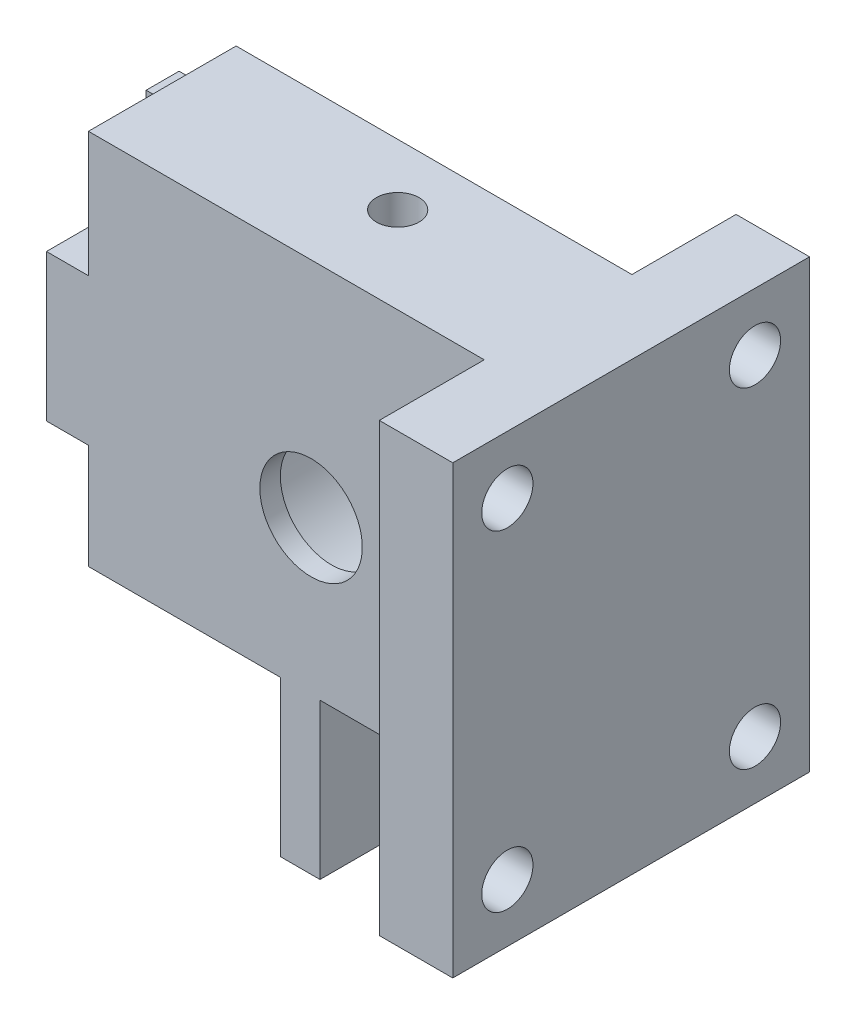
SolidWorks part; units mm, degrees
ref_plane "Front" through (0, 0, 0) normal (0, 0, 1) x (1, 0, 0)
ref_plane "Top" through (0, 0, 0) normal (0, 1, 0) x (1, 0, 0)
ref_plane "Right" through (0, 0, 0) normal (1, 0, 0) x (0, 0, -1)
sketch "Sketch1" plane through (0, 0, 0) normal (0, 0, 1) x (1, 0, 0)
  line L0 (53.34, 11.811) -> (53.34, -11.811) construction
  line L1 (3.9672, 13.5001) -> (40.34, 13.5001)
  line L2 (3.9672, 13.5001) -> (3.9672, -13.5001)
  line L3 (3.9672, -13.5001) -> (40.34, -13.5001)
  line L4 (40.34, 13.5001) -> (40.34, -13.5001)
  circle A0 centre (0, 0) radius 7.9375 construction
  circle A1 centre (25.4, 0) radius 8.5 construction
  point P4 (3.9672, 0)
  dimension "D1" = 15.875
  dimension "D2" = 17
  dimension "D3" = 36.3728
  dimension "D9" = 13
  dimension "D4" = 25.4
  dimension "D6" = 53.34
  dimension "D7" = 27.0002
extrude "Extrude1" add sketch "Sketch1" along normal blind 21.59
sketch "Sketch12" plane through (0, 0, 0) normal (0, 0, -1) x (-1, 0, 0)
  circle A0 centre (0, 0) radius 7.9375
  dimension "D1" = 15.875
sketch "Sketch16" plane through (0, 0, 0) normal (0, 0, -1) x (-1, 0, 0)
  line L0 (-40.34, 13.5001) -> (-3.9672, 13.5001) construction
  line L1 (-40.34, -13.5001) -> (-40.34, 13.5001) construction
  line L2 (-11.9428, 13.5001) -> (-11.9428, -13.5001)
  line L4 (-35.895, -13.5001) -> (-35.895, 13.5001) construction
  line L5 (-11.9428, 13.5001) -> (3.2177, 13.5001)
  line L6 (-11.9428, -13.5001) -> (3.2177, -13.5001)
  line L7 (3.2177, -13.5001) -> (3.2177, 13.5001)
  dimension "D1" = 4.445
  dimension "D2" = 28.3972
extrude "Cut-Extrude5" cut sketch "Sketch16" against normal offset from surface (1.778 mm away) 19.812
sketch "Sketch33" plane through (0, 0, 0) normal (0, 1, 0) x (1, 0, 0)
  line L0 (40.34, -21.59) -> (40.34, 0) construction
  line L1 (-3.4131, -28.892) -> (35.895, -28.892)
  line L2 (-3.4131, -28.892) -> (-3.4131, -15.24)
  line L3 (-3.4131, -15.24) -> (35.895, -15.24)
  line L4 (35.895, -28.892) -> (35.895, -15.24)
  line L5 (40.34, 0) -> (11.9428, 0) construction
  dimension "D1" = 4.445
  dimension "D2" = 15.24
extrude "Cut-Extrude6" cut sketch "Sketch33" against normal through all and the other way through all
ref_plane "Plane1" through (0, 0, 4.445) normal (0, 0, 1) x (1, 0, 0)
sketch "Sketch20" plane through (0, 0, 0) normal (0, 0, -1) x (-1, 0, 0)
  line L0 (-24.765, 1.4431) -> (-24.765, -20.0804) construction
  line L1 (-32.385, -9.3091) -> (-3.9672, -9.3091)
  line L2 (-32.385, -9.3091) -> (-32.385, -15.3438)
  line L3 (-32.385, -15.3438) -> (-3.9672, -15.3438)
  line L4 (-3.9672, -9.3091) -> (-3.9672, -15.3438)
  line L5 (-11.9428, -13.5001) -> (-40.34, -13.5001) construction
  line L6 (-3.9672, 13.5001) -> (-3.9672, -13.5001) construction
  dimension "D1" = 24.765
  dimension "D2" = 4.191
  dimension "D3" = 7.62
extrude "Cut-Extrude1" cut sketch "Sketch20" against normal through all
sketch "Sketch21" plane through (0, -9.3091, 0) normal (0, -1, 0) x (1, 0, 0)
  line L1 (23.5744, 15.24) -> (25.9556, 15.24)
  line L2 (23.5744, 15.24) -> (23.5744, 6.35)
  line L3 (23.5744, 6.35) -> (25.9556, 6.35)
  line L4 (25.9556, 15.24) -> (25.9556, 6.35)
  line L6 (24.765, 15.24) -> (24.765, 3.3753) construction
  line L7 (3.9672, 15.24) -> (32.385, 15.24) construction
  dimension "D1" = 2.3813
  dimension "D2" = 24.765
  dimension "D3" = 8.89
extrude "Sensor Tab" add sketch "Sketch21" along normal blind 9.398
ref_plane "SENSOR" through (24.765, 0, 0) normal (1, 0, 0) x (0, 0, -1)
sketch "Sketch34" plane through (0, 0, 0) normal (0, 0, -1) x (-1, 0, 0)
  line L0 (-40.34, 13.5001) -> (-11.9428, 13.5001) construction
  line L1 (-40.34, -13.5001) -> (-40.34, 13.5001) construction
  circle A0 centre (-25.4175, -0.0127) radius 6
  dimension "D3" = 12
  dimension "D1" = 13.5128
  dimension "D2" = 14.9225
extrude "Ball Nut Bore" cut sketch "Sketch34" against normal blind 14
hole_wizard "Ø6.2 (6.2) Diameter Hole1" positions "Sketch43" profile "Sketch42" hole size "Ø6.2" standard "Ansi Metric"
sketch "Sketch43" plane through (0, 0, 0) normal (0, 0, -1) x (-1, 0, 0)
  point P0 (-25.4175, -0.0127)
sketch "Sketch42" plane through (25.4175, -0.0127, 0) normal (1, 0, 0) x (0, 1, 0)
  line L0 (0, 0) -> (0, 21.59)
  line L1 (0, 21.59) -> (3.1, 21.59)
  line L2 (3.1, 21.59) -> (3.1, 0)
  line L5 (3.1, 0) -> (0, 0)
  line L11 (0, -6.35) -> (0, 107.95) construction
  dimension "Thru Hole Dia." = 6.2
  dimension "Thru Hole Depth" = 21.59
sketch "Sketch35" plane through (0, 0, 1.778) normal (0, 0, -1) x (-1, 0, 0)
  line L0 (-11.9428, 13.5001) -> (-11.9428, -9.3091) construction
  line L1 (-11.9428, 13.5001) -> (-1.4852, 13.5001)
  line L2 (-11.9428, 13.5001) -> (-11.9428, 5.9309)
  line L3 (-11.9428, 5.9309) -> (-1.4852, 5.9309)
  line L4 (-1.4852, 13.5001) -> (-1.4852, 5.9309)
  line L5 (-11.9428, -2.954) -> (-1.4852, -2.954)
  line L6 (-11.9428, -2.954) -> (-11.9428, -14.1692)
  line L7 (-11.9428, -14.1692) -> (-1.4852, -14.1692)
  line L8 (-1.4852, -2.954) -> (-1.4852, -14.1692)
  dimension "D1" = 7.5692
  dimension "D2" = 8.8849
extrude "Cut-Extrude8" cut sketch "Sketch35" against normal through all
sketch "Sketch36" plane through (0, 0, 0) normal (0, 1, 0) x (1, 0, 0)
  line L0 (40.34, 0) -> (11.9428, 0) construction
  line L1 (2.2222, -26.4633) -> (17.5862, -26.4633) construction
  line L2 (2.2222, -26.4633) -> (2.2222, -19.812) construction
  line L3 (2.2222, -19.812) -> (17.5862, -19.812) construction
  line L4 (17.5862, -26.4633) -> (17.5862, -19.812) construction
  line L5 (2.2222, -16.002) -> (9.4028, -16.002)
  line L6 (2.2222, -16.002) -> (2.2222, -3.7709)
  line L7 (2.2222, -3.7709) -> (9.4028, -3.7709)
  line L8 (9.4028, -16.002) -> (9.4028, -3.7709)
  line L9 (40.34, -21.59) -> (40.34, 0) construction
  dimension "D1" = 16.002
  dimension "D2" = 19.812
  dimension "D3" = 30.9372
extrude "Cut-Extrude9" cut sketch "Sketch36" against normal through all and the other way through all
hole_wizard "Ø3.1 (3.1) Diameter Hole1" positions "Sketch38" profile "Sketch37" hole size "Ø3.1" standard "Ansi Metric"
sketch "Sketch38" plane through (40.34, 0, 0) normal (1, 0, 0) x (0, 0, -1)
  line L0 (-21.59, 13.5001) -> (0, 13.5001) construction
  line L1 (-21.59, -13.5001) -> (-21.59, 13.5001) construction
  point P0 (-18.288, 9.9949)
  point P3 (-18.288, -9.9949)
  point P7 (-3.302, 9.9949)
  point P9 (-3.302, -9.9949)
  dimension "D1" = 3.5052
  dimension "D2" = 19.9898
  dimension "D3" = 3.302
  dimension "D4" = 14.986
sketch "Sketch37" plane through (40.34, 9.9949, 18.288) normal (0, 1, 0) x (0, 0, -1)
  line L0 (0, 0) -> (0, 36.3728)
  line L1 (0, 36.3728) -> (1.55, 36.3728)
  line L2 (1.55, 36.3728) -> (1.55, 0)
  line L5 (1.55, 0) -> (0, 0)
  line L11 (0, -6.35) -> (0, 107.95) construction
  dimension "Thru Hole Dia." = 3.1
  dimension "Thru Hole Depth" = 36.3728
sketch "Sketch41" plane through (11.9428, 0, 0) normal (-1, 0, 0) x (0, 0, 1)
  line L0 (3.302, 6.9945) -> (-5.6294, 6.9945)
  line L1 (6.3024, 9.9949) -> (6.3024, 17.1363)
  line L2 (6.3024, -9.9945) -> (6.3037, -20.9458)
  line L3 (3.302, -6.9945) -> (-3.9289, -6.9945)
  line L4 (6.3037, -20.9458) -> (-3.9289, -20.9458)
  line L5 (-3.9289, -20.9458) -> (-3.9289, -6.9945)
  line L6 (6.3024, 17.1363) -> (-5.6294, 17.1363)
  line L7 (-5.6294, 17.1363) -> (-5.6294, 6.9945)
  arc A0 (3.302, 6.9945) -> (6.3024, 9.9949) centre (3.302, 9.9949) ccw
  arc A1 (6.3024, -9.9945) -> (3.302, -6.9945) centre (3.302, -9.9949) ccw
  dimension "D1" = 3.0004
extrude "M3 CNTR Bore" cut sketch "Sketch41" against normal up to surface (23.9522 mm away)
hole_wizard "#5-40 Tapped Hole1" positions "Sketch40" profile "Sketch39" tap size "#5-40" standard "Ansi Inch"
sketch "Sketch40" plane through (11.9428, 0, 0) normal (-1, 0, 0) x (0, 0, 1)
  line L0 (21.59, 13.5001) -> (0, 13.5001) construction
  line L1 (21.59, -13.5001) -> (21.59, 13.5001) construction
  point P0 (10.795, 9.6901)
  point P1 (10.795, -6.1341)
  dimension "D1" = 3.81
  dimension "D2" = 10.795
  dimension "D3" = 15.8242
sketch "Sketch39" plane through (11.9428, 9.6901, 10.795) normal (0, 1, 0) x (0, 0, 1)
  line L0 (0, 0) -> (0, 5.9307)
  line L1 (0, 5.9307) -> (1.289, 5.1562)
  line L2 (1.289, 5.1562) -> (1.289, 0)
  line L5 (1.289, 0) -> (0, 0)
  line L10 (0, 5.9307) -> (-1.2891, 5.1562) construction
  line L11 (0, -6.35) -> (0, 107.95) construction
  dimension "Tap Drill Dia." = 2.5781
  dimension "Tap Drill Depth" = 5.1562
  dimension "Drill Angle" = 118
hole_wizard "M3.5x0.6 Tapped Hole1" positions "Sketch29" profile "Sketch28" tap size "M3.5x0.6" standard "Ansi Metric"
sketch "Sketch29" plane through (1.838, 5.5994, 1.778) normal (0, 0, -1) x (-1, 0, 0)
  line L1 (-38.502, 7.9007) -> (-34.057, 7.9007) construction
  line L2 (-38.502, -19.0995) -> (-38.502, 7.9007) construction
  point P0 (-4.847, -4.1135)
  dimension "D1" = 12.0142
  dimension "D2" = 33.655
sketch "Sketch28" plane through (6.685, 1.4859, 1.778) normal (1, 0, 0) x (0, 1, 0)
  line L0 (0, 0) -> (0, 19.812)
  line L1 (0, 19.812) -> (1.45, 19.812)
  line L2 (1.45, 19.812) -> (1.45, 0)
  line L5 (1.45, 0) -> (0, 0)
  line L11 (0, -6.35) -> (0, 107.95) construction
  dimension "Thru Tap Drill Dia." = 2.9
  dimension "Thru Tap Drill Depth" = 19.812
sketch "Sketch44" plane through (0, 13.5001, 0) normal (0, 1, 0) x (-1, 0, 0)
  line L0 (-40.34, 0) -> (-35.895, 0) construction
  line L1 (-40.34, 21.59) -> (-40.34, 0) construction
  line L2 (-24.4175, 10) -> (-24.4175, 4)
  line L4 (-26.4175, 10) -> (-26.4175, 4)
  arc A0 (-24.4175, 4) -> (-26.4175, 4) centre (-25.4175, 4) cw
  arc A1 (-26.4175, 10) -> (-24.4175, 10) centre (-25.4175, 10) cw
  dimension "D1" = 6
  dimension "D2" = 2
  dimension "D3" = 4
  dimension "D4" = 14.9225
hole_wizard "#5-40 Tapped Hole2" positions "Sketch46" profile "Sketch45" tap size "#5-40" standard "Ansi Inch"
sketch "Sketch46" plane through (0, 13.5001, 0) normal (0, 1, 0) x (-1, 0, 0)
  point P0 (-25.4175, 10)
sketch "Sketch45" plane through (25.4175, 13.5001, 10) normal (1, 0, 0) x (0, 0, 1)
  line L0 (0, 0) -> (0, 10.2995)
  line L1 (0, 10.2995) -> (1.289, 9.525)
  line L2 (1.289, 9.525) -> (1.289, 0)
  line L5 (1.289, 0) -> (0, 0)
  line L10 (0, 10.2995) -> (-1.2891, 9.525) construction
  line L11 (0, -6.35) -> (0, 107.95) construction
  dimension "Tap Drill Dia." = 2.5781
  dimension "Tap Drill Depth" = 9.525
  dimension "Drill Angle" = 118
